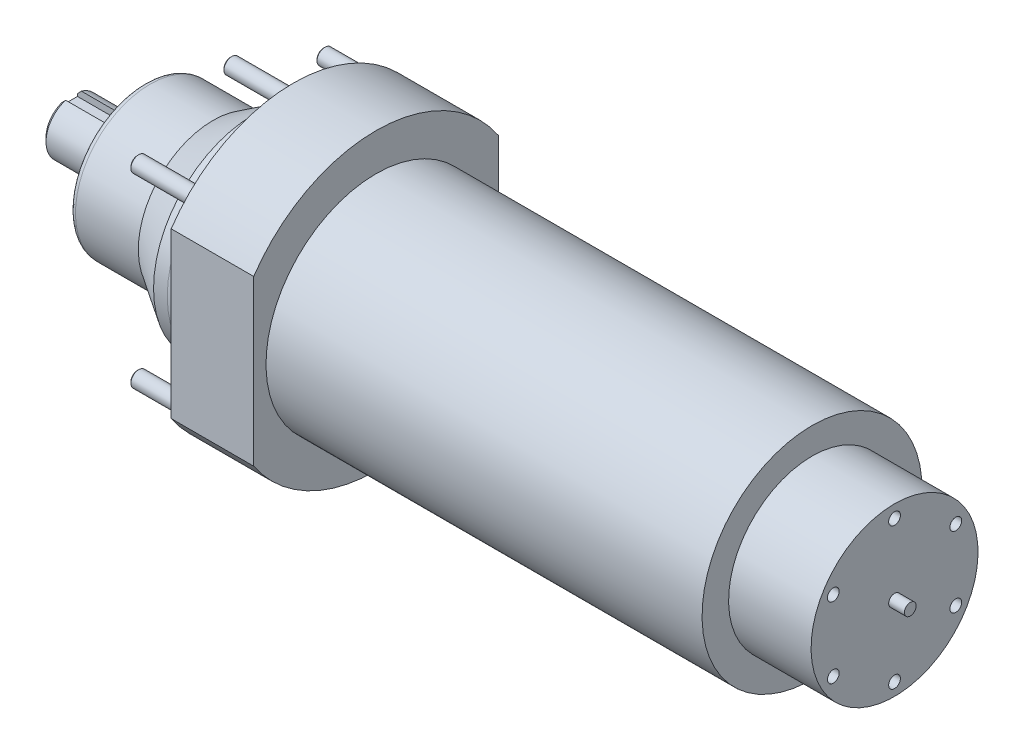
SolidWorks part; units mm, degrees
ref_plane "Plan1" through (0, 0, 0) normal (0, 0, 1) x (1, 0, 0)
ref_plane "Plan2" through (0, 0, 0) normal (0, 1, 0) x (1, 0, 0)
ref_plane "Plan3" through (0, 0, 0) normal (1, 0, 0) x (0, 0, -1)
sketch "Esquisse1" plane through (0, 0, 0) normal (0, 0, 1) x (1, 0, 0)
  line L0 (80, 0) -> (-344.2474, 0) construction
  line L1 (-344.2474, 0) -> (-344.2474, 14)
  line L2 (-344.2474, 14) -> (-309.2474, 14)
  line L3 (-306.2474, 18) -> (-306.2474, 35)
  line L4 (-303.2474, 38) -> (-271.2474, 38)
  line L5 (-243.2647, 51.25) -> (-236.2474, 52.5)
  line L6 (-236.2474, 52.5) -> (-230.2474, 52.5)
  line L7 (-230.2474, 52.5) -> (-230.2474, 75)
  line L8 (-230.2474, 75) -> (-188.2474, 75)
  line L9 (-188.2474, 75) -> (-188.2474, 56)
  line L10 (-188.2474, 56) -> (33.7526, 56)
  line L11 (33.7526, 56) -> (33.7526, 42.5)
  line L12 (33.7526, 42.5) -> (75.7526, 42.5)
  line L13 (75.7526, 42.5) -> (75.7526, 0)
  line L14 (-344.2474, 0) -> (75.7526, 0)
  line L15 (-309.2474, 14) -> (-309.2474, 18)
  line L16 (-309.2474, 18) -> (-306.2474, 18)
  line L17 (-243.2647, 51.25) -> (-250.2474, 51.25)
  line L18 (-250.2474, 51.25) -> (-271.2474, 38)
  arc A0 (-303.2474, 38) -> (-306.2474, 35) centre (-303.2474, 35) ccw
  dimension "D3" = 3
  dimension "D1" = 14
  dimension "D2" = 38
  dimension "D4" = 38
  dimension "D5" = 6
  dimension "D6" = 156
  dimension "D7" = 114
  dimension "D8" = 222
  dimension "D9" = 42
  dimension "D10" = 42.5
  dimension "D11" = 56
  dimension "D12" = 75
  dimension "D13" = 52.5
  dimension "D14" = 35
  dimension "D15" = 35
  dimension "D16" = 4
  dimension "D17" = 51.25
  dimension "D18" = 14
revolve "Base-Révolution" add sketch "Esquisse1" angle 360 about L0
sketch "Esquisse2" plane through (-230.2474, 0, 0) normal (-1, 0, 0) x (0, 0, 1)
  circle A0 centre (0, 67) radius 3.4
  dimension "D1" = 67
  dimension "D2" = 6.8
extrude "Enlèv. mat.-Extru.1" cut sketch "Esquisse2" against normal through all
pattern_circular "Répétition circulaire1" count 8 every 45 about axis through (0, 0, 0) along (1, 0, 0) of "Enlèv. mat.-Extru.1"
sketch "Esquisse3" plane through (0, 0, 0) normal (0, 0, 1) x (1, 0, 0)
  line L0 (-344.2474, 14) -> (-344.2474, 10.0682)
  line L1 (-344.2474, 14) -> (-344.2474, -14) construction
  line L2 (-344.2474, 10.0682) -> (-319.2982, 10.0682)
  line L3 (-314.5239, 14) -> (-344.2474, 14)
  arc A0 (-319.2982, 10.0682) -> (-314.5239, 14) centre (-319.2982, 14.9328) ccw
extrude "Enlèv. mat.-Extru.2" cut sketch "Esquisse3" against normal mid plane 8
chamfer "Chanfrein1" distance 2 angle 45 1 edges at (-344.2474, -14, 0)
sketch "Esquisse8" plane through (75.7526, 0, 0) normal (1, 0, 0) x (0, 0, -1)
  circle A0 centre (0, 0) radius 3
  dimension "D1" = 6
extrude "Boss.-Extru.1" add sketch "Esquisse8" along normal blind 8
sketch "Esquisse10" plane through (-188.2474, 0, 0) normal (1, 0, 0) x (0, 0, -1)
  line L0 (-62.25, 41.8323) -> (-62.25, -41.8323)
  line L2 (62.25, 41.8323) -> (62.25, -41.8323)
  line L4 (0, 88.7003) -> (0, -88.7003) construction
  circle A0 centre (0, 0) radius 75 construction
  arc A1 (-62.25, 41.8323) -> (-62.25, -41.8323) centre (0, 0) ccw
  arc A2 (62.25, -41.8323) -> (62.25, 41.8323) centre (0, 0) ccw
  dimension "D1" = 124.5
extrude "Enlèv. mat.-Extru.3" cut sketch "Esquisse10" against normal through all
sketch "Esquisse13" plane through (75.7526, 0, 0) normal (1, 0, 0) x (0, 0, -1)
  line L0 (0, 0) -> (0, -36) construction
  line L1 (0, 0) -> (-31.1769, 18) construction
  line L2 (0, 0) -> (31.1769, 18) construction
  circle A0 centre (0, -36) radius 3
  circle A1 centre (-31.1769, 18) radius 3
  circle A2 centre (31.1769, 18) radius 3
  circle A3 centre (0, 0) radius 36 construction
  dimension "D3" = 6
  dimension "D4" = 72
  dimension "D1" = 120
  dimension "D2" = 120
  dimension "D5" = 62.3538
extrude "Enlèv. mat.-Extru.5" cut sketch "Esquisse13" against normal blind 20
sketch "Esquisse14" plane through (-344.2474, 0, 0) normal (-1, 0, 0) x (0, 0, 1)
  circle A0 centre (0, 0) radius 3.4
  dimension "D1" = 6.8
extrude "Enlèv. mat.-Extru.6" cut sketch "Esquisse14" against normal blind 16
pattern_circular "Répétition circulaire2" count 2 every 60 about axis through (0, 0, 0) along (1, 0, 0) of "Enlèv. mat.-Extru.5"
sketch "Esquisse15" plane through (0, 0, 0) normal (0, 0, 1) x (1, 0, 0)
  line L0 (-188.2474, 41.8323) -> (-188.2474, -41.8323) construction
  line L1 (-188.2474, 56) -> (83.7526, 56)
  line L2 (-188.2474, 56) -> (-188.2474, -56)
  line L3 (-188.2474, -56) -> (83.7526, -56)
  line L4 (83.7526, 56) -> (83.7526, -56)
  line L5 (33.7526, 56) -> (-188.2474, 56) construction
  line L6 (-188.2474, -56) -> (33.7526, -56) construction
  line L7 (83.7526, -3) -> (83.7526, 3) construction
extrude "Enlèv. mat.-Extru.7" cut sketch "Esquisse15" against normal mid plane 130
sketch "Esquisse16" plane through (-188.2474, 0, 0) normal (1, 0, 0) x (0, 0, -1)
  circle A0 centre (-47.3762, 47.3762) radius 4
  circle A1 centre (0, 67) radius 4
  circle A2 centre (47.3762, 47.3762) radius 4
  circle A3 centre (47.3762, -47.3762) radius 4
  circle A4 centre (0, -67) radius 4
  circle A5 centre (-47.3762, -47.3762) radius 4
  circle A6 centre (-47.3762, 47.3762) radius 3.4 construction
  circle A7 centre (0, 67) radius 3.4 construction
  circle A8 centre (47.3762, 47.3762) radius 3.4 construction
  circle A9 centre (47.3762, -47.3762) radius 3.4 construction
  circle A10 centre (0, -67) radius 3.4 construction
  circle A11 centre (-47.3762, -47.3762) radius 3.4 construction
  dimension "D1" = 8
extrude "Boss.-Extru.2" add sketch "Esquisse16" against normal blind 74
chamfer "Chanfrein2" distance 0.6 angle 45 6 edges at (-262.2474, 51.3762, -47.3762) (-262.2474, 71, 0) (-262.2474, 51.3762, 47.3762) (-262.2474, -43.3762, 47.3762) (-262.2474, -63, 0) (-262.2474, -43.3762, -47.3762)
